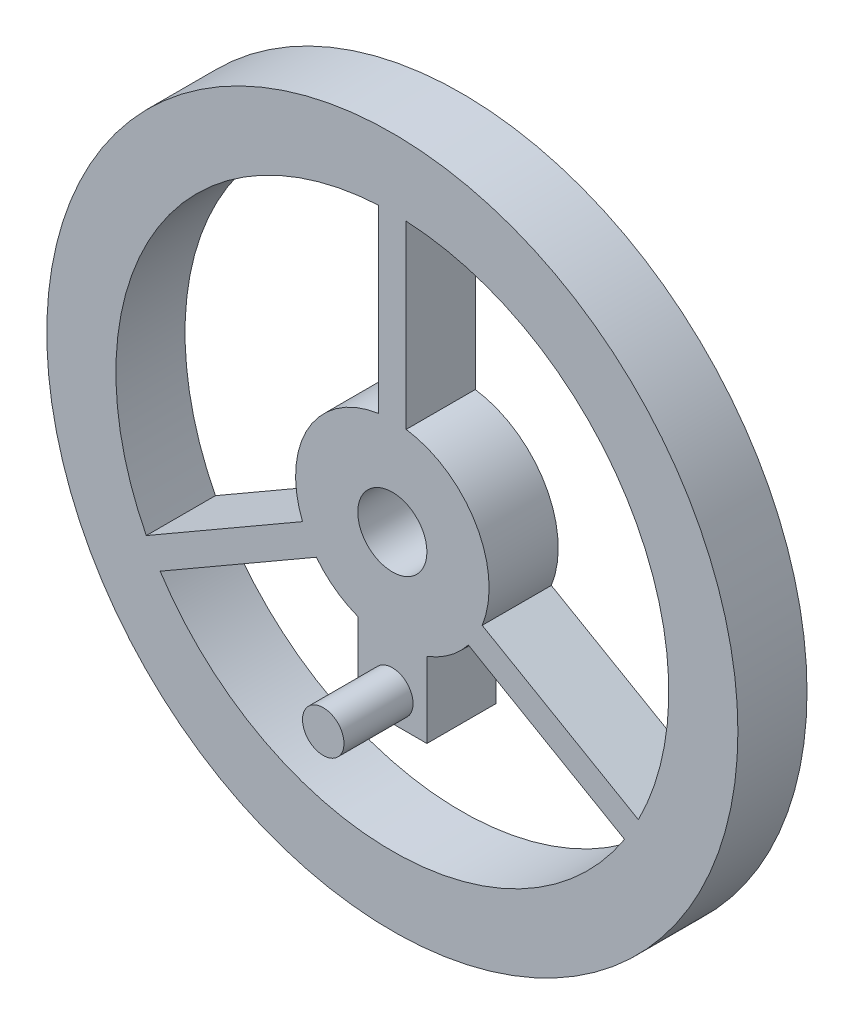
SolidWorks part; units mm, degrees
ref_plane "Front Plane" through (0, 0, 0) normal (0, 0, 1) x (1, 0, 0)
ref_plane "Top Plane" through (0, 0, 0) normal (0, 1, 0) x (1, 0, 0)
ref_plane "Right Plane" through (0, 0, 0) normal (1, 0, 0) x (0, 0, -1)
sketch "Sketch1" plane through (0, 0, 0) normal (0, 0, 1) x (1, 0, 0)
sketch_block_instance "Block-Wheel-2-1"
sketch_block "Block-Wheel-2" parameters "D1"=50, "D2"=20, "D4"=7, "D5"=5, "D8"=3, "D3"=2, "D6"=5, "D7"=2, "D9"=12
extrude "Boss-Extrude1" add sketch "Sketch1" against normal blind 5
extrude "Boss-Extrude2" add sketch "Sketch1<7>" along normal mid plane 10
sketch "Sketch1<7>"
